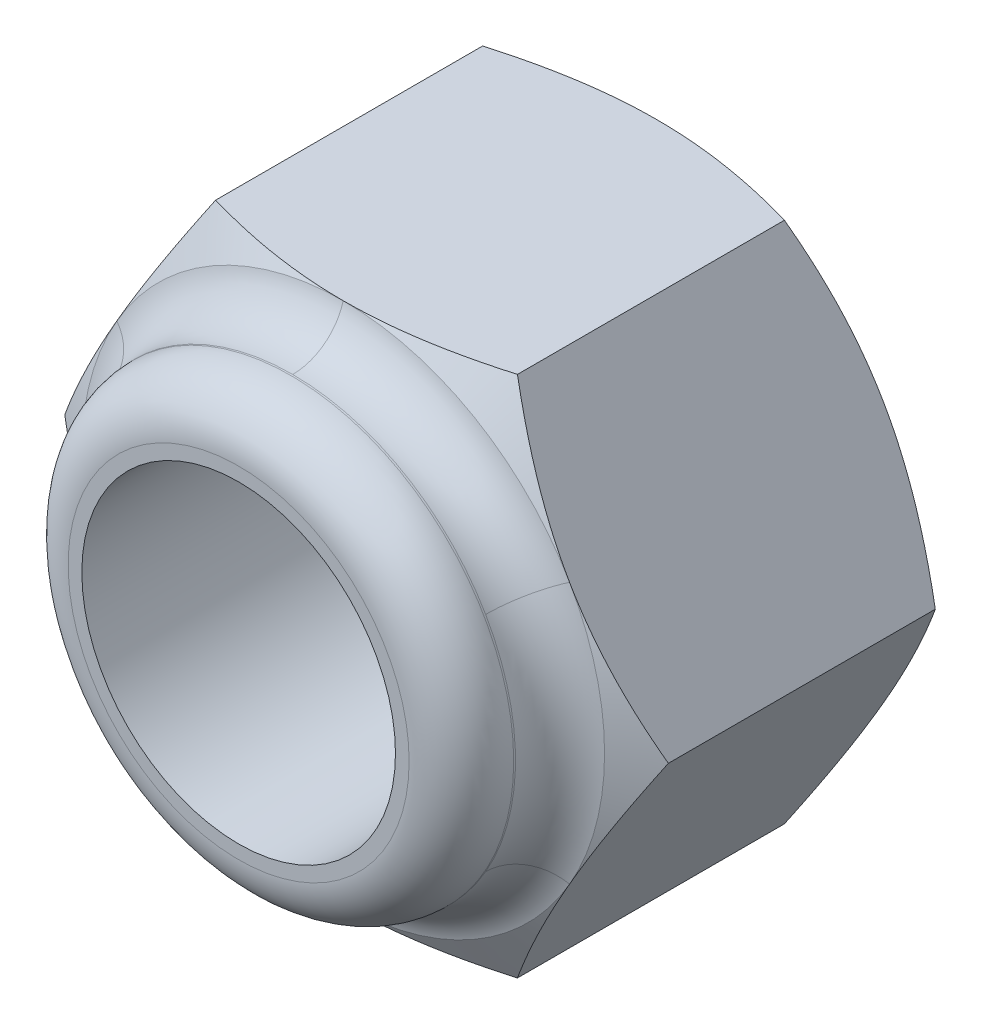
SolidWorks part; units mm, degrees
ref_plane "Plan1" through (0, 0, 0) normal (0, 0, 1) x (1, 0, 0)
ref_plane "Plan2" through (0, 0, 0) normal (0, 1, 0) x (1, 0, 0)
ref_plane "Plan3" through (0, 0, 0) normal (1, 0, 0) x (0, 0, -1)
sketch "Esquisse1" plane through (0, 0, 0) normal (0, 0, 1) x (1, 0, 0)
  line L0 (-2.8868, -5) -> (-5.7735, 0)
  line L1 (2.8868, -5) -> (-2.8868, -5)
  line L2 (5.7735, 0) -> (2.8868, -5)
  line L3 (-5.7735, 0) -> (-2.8868, 5)
  line L4 (-2.8868, 5) -> (2.8868, 5)
  line L5 (2.8868, 5) -> (5.7735, 0)
  circle A0 centre (0, 0) radius 3
  dimension "D6" = 6
  dimension "D1" = 5
  dimension "D2" = 5
  dimension "D3" = 5
  dimension "D4" = 5
  dimension "D5" = 5
extrude "Base-Extrusion" add sketch "Esquisse1" along normal blind 6
sketch "Esquisse2" plane through (0, 0, 0) normal (0, 0, -1) x (-1, 0, 0)
  line L0 (-2.8868, 5) -> (-5.7735, 0) construction
  circle A0 centre (0, 0) radius 6.6203
  circle A1 centre (0, 0) radius 5
extrude "Enlèv. mat.-Extru.1" cut sketch "Esquisse2" against normal blind 5 draft 60
sketch "Esquisse3" plane through (0, 0, 6) normal (0, 0, 1) x (1, 0, 0)
  line L0 (-5.7735, 0) -> (-2.8868, 5) construction
  circle A0 centre (0, 0) radius 5
  circle A1 centre (0, 0) radius 6.7937
extrude "Enlèv. mat.-Extru.2" cut sketch "Esquisse3" against normal blind 5 draft 60
sketch "Esquisse4" plane through (0, 0, 6) normal (0, 0, 1) x (1, 0, 0)
  circle A0 centre (0, 0) radius 4.2614
  circle A1 centre (0, 0) radius 3
  dimension "D1" = 8.5228
extrude "Boss.-Extru.1" add sketch "Esquisse4" along normal blind 2
fillet "Congé2" radius 1
fillet "Congé3" radius 1
